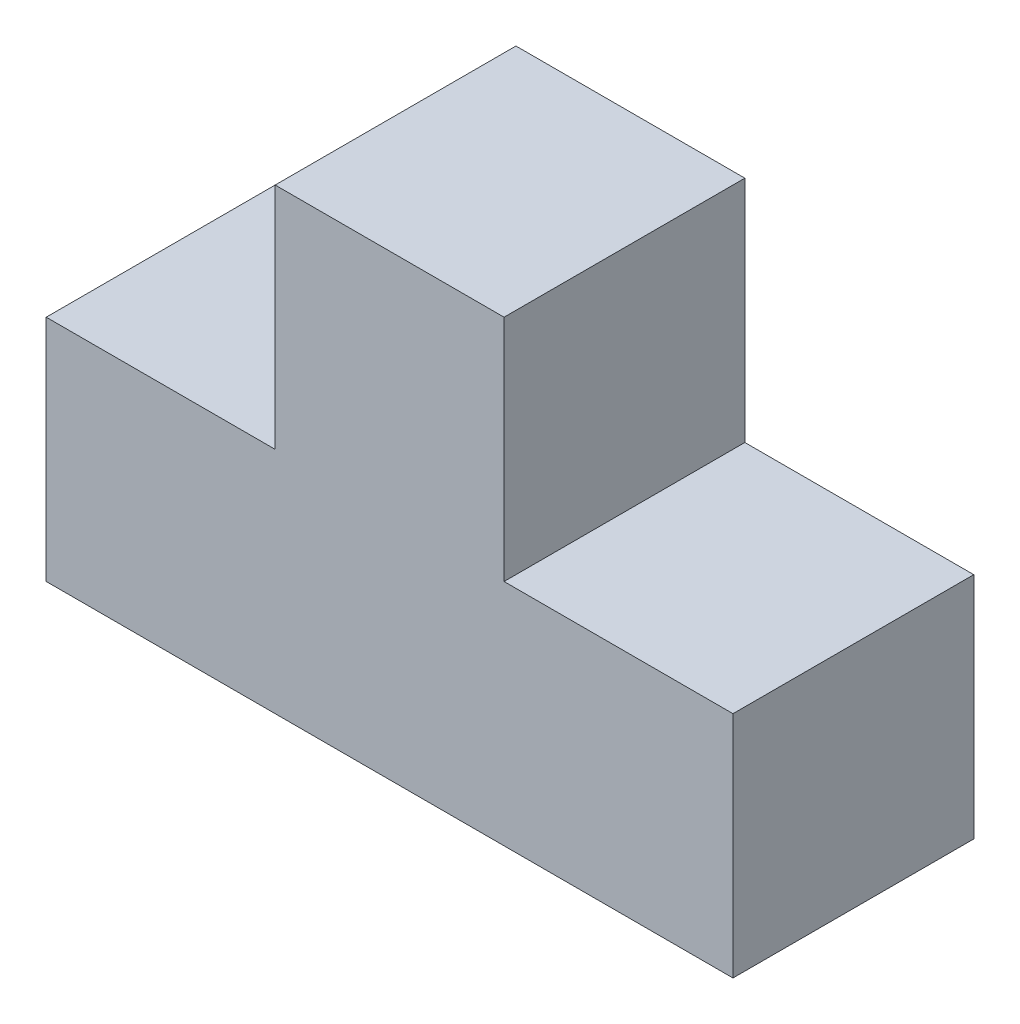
SolidWorks part; units mm, degrees
ref_plane "Front Plane" through (0, 0, 0) normal (0, 0, 1) x (1, 0, 0)
ref_plane "Top Plane" through (0, 0, 0) normal (0, 1, 0) x (1, 0, 0)
ref_plane "Right Plane" through (0, 0, 0) normal (1, 0, 0) x (0, 0, -1)
sketch "Sketch1" plane through (0, 0, 0) normal (0, 0, 1) x (1, 0, 0)
  line L0 (-36.9075, 0) -> (-36.9075, 36.2209)
  line L1 (55, 0) -> (-55, 0) construction
  line L2 (-36.9075, 36.2209) -> (-0.6867, 36.2209)
  line L3 (-0.6867, 36.2209) -> (-0.6867, 72.4417)
  line L4 (-0.6867, 72.4417) -> (35.5342, 72.4417)
  line L5 (35.5342, 72.4417) -> (35.5342, 36.2209)
  line L6 (35.5342, 36.2209) -> (71.7551, 36.2209)
  line L7 (71.7551, 36.2209) -> (71.7551, 0)
  line L8 (71.7551, 0) -> (-36.9075, 0)
extrude "Extrude1" add sketch "Sketch1" along normal blind 38.1
